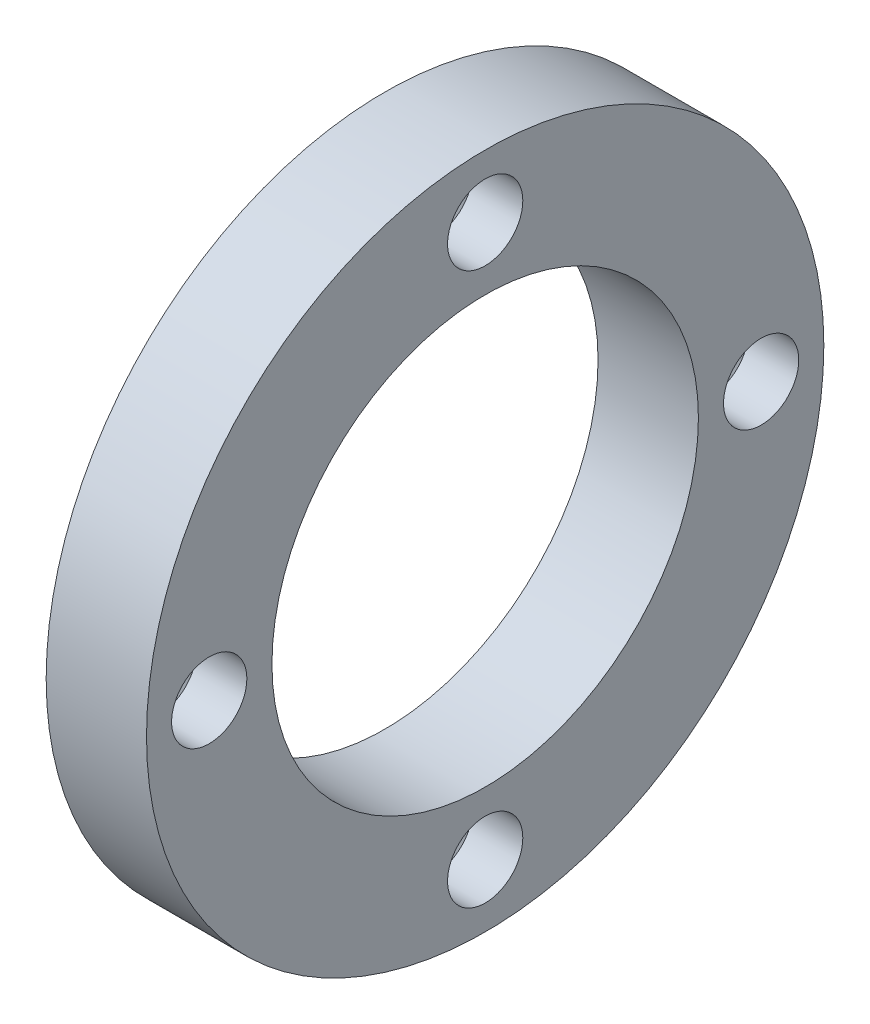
SolidWorks part; units mm, degrees
ref_plane "Vorne" through (0, 0, 0) normal (0, 0, 1) x (1, 0, 0)
ref_plane "Oben" through (0, 0, 0) normal (0, 1, 0) x (1, 0, 0)
ref_plane "Rechts" through (0, 0, 0) normal (1, 0, 0) x (0, 0, -1)
sketch "Skizze1" plane through (0, 0, 0) normal (0, 0, 1) x (1, 0, 0)
  line L0 (0, 0) -> (34.4086, 0) construction
  line L2 (0, 13.5) -> (4, 13.5)
  line L3 (0, 13.5) -> (0, 8.5)
  line L4 (0, 8.5) -> (4, 8.5)
  line L5 (4, 13.5) -> (4, 8.5)
  dimension "D1" = 17
  dimension "D2" = 27
  dimension "D3" = 4
revolve "Rotation1" add sketch "Skizze1" angle 360 about L0
hole_wizard "Ø3.0 (3) Durchmesser Bohrung1" positions "Skizze5" profile "Skizze4" hole size "Ø3.0" standard "ISO"
sketch "Skizze5" plane through (4, 0, 0) normal (1, 0, 0) x (0, 0, -1)
  point P0 (0, 11)
  dimension "D1" = 11
sketch "Skizze4" plane through (4, 11, 0) normal (0, 1, 0) x (0, 0, -1)
  line L0 (0, 0) -> (0, 2.9013)
  line L1 (0, 2.9013) -> (1.5, 2)
  line L2 (1.5, 2) -> (1.5, 0)
  line L5 (1.5, 0) -> (0, 0)
  line L10 (0, 2.9013) -> (-1.5, 2) construction
  line L11 (0, -6.35) -> (0, 107.95) construction
  dimension "Bohrerdurchmesser" = 3
  dimension "Bohrungstiefe" = 2
  dimension "Spitzenwinkel" = 118
pattern_circular "Kreismuster1" count 4 over 360 about axis through (0, 0, 0) along (1, 0, 0) of "Ø3.0 (3) Durchmesser Bohrung1"
